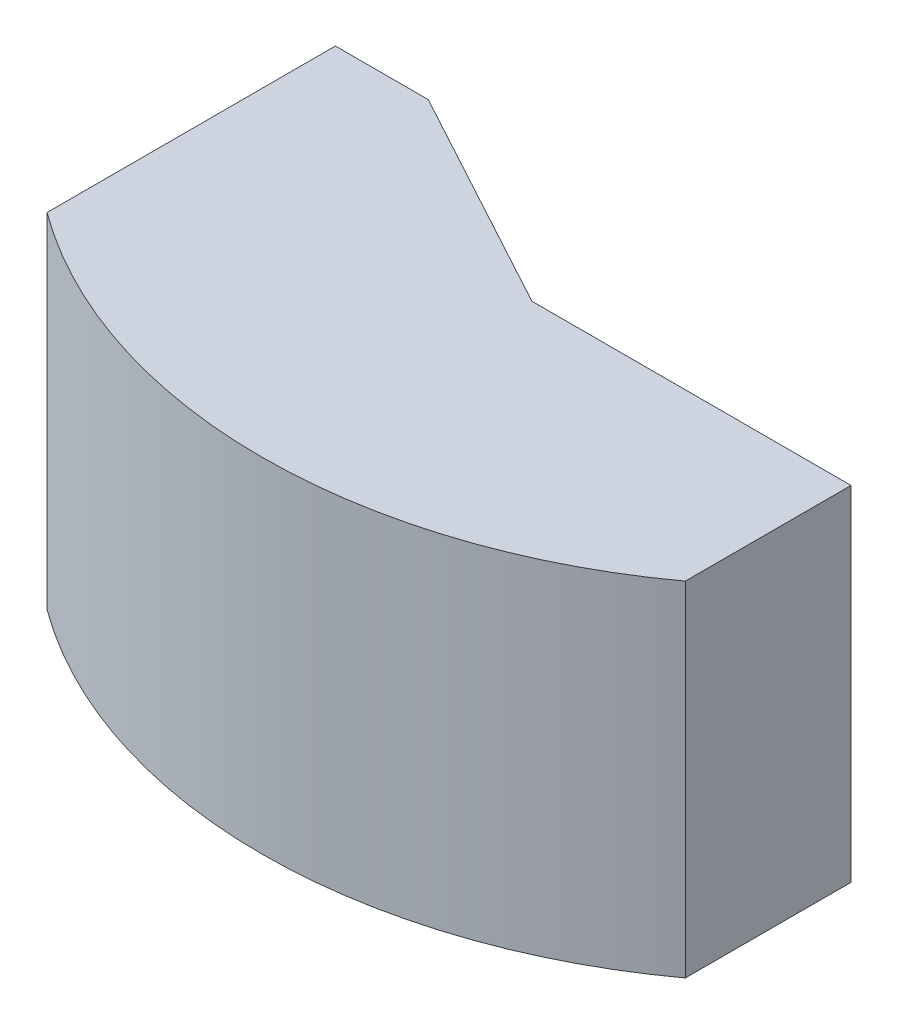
SolidWorks part; units mm, degrees
ref_plane "Front Plane" through (0, 0, 0) normal (0, 0, 1) x (1, 0, 0)
ref_plane "Top Plane" through (0, 0, 0) normal (0, 1, 0) x (1, 0, 0)
ref_plane "Right Plane" through (0, 0, 0) normal (1, 0, 0) x (0, 0, -1)
sketch "Sketch1" plane through (0, 0, 0) normal (0, 0, 1) x (1, 0, 0)
  line L0 (0, 0) -> (0, 88.9688) construction
  line L1 (-12.7, 0) -> (-132.7199, 0) construction
  line L2 (-38.1, 2.54) -> (-38.1, 78.74)
  line L3 (-53.975, 91.44) -> (-139.7, 91.44)
  line L4 (0, 0) -> (-12.7, 0) construction
  line L5 (-38.1, 2.54) -> (-139.7, 2.54)
  line L6 (-139.7, 2.54) -> (-139.7, 91.44)
  line L7 (-53.975, 91.44) -> (-41.275, 78.74)
  line L8 (-41.275, 78.74) -> (-38.1, 78.74)
  dimension "D1" = 88.9
  dimension "D2" = 76.2
  dimension "D3" = 76.2
  dimension "D4" = 2.54
  dimension "D5" = 279.4
  dimension "D6" = 3.175
  dimension "D7" = 135
revolve "Revolve1" add sketch "Sketch1" angle 360 about L0
sketch "Sketch2" plane through (0, 91.44, 0) normal (0, -1, 0) x (1, 0, 0)
  line L0 (0, 0) -> (0, 50.8) construction
  line L1 (-152.4, 171.9606) -> (-152.4, 130.6562)
  line L2 (82.55, 69.85) -> (82.55, 182.9817)
  line L3 (-82.55, 171.9606) -> (-82.55, 38.1)
  line L4 (-82.55, 38.1) -> (-58.5441, 38.1)
  line L5 (-82.55, 171.9606) -> (-152.4, 171.9606)
  line L6 (0, 69.85) -> (-58.5441, 38.1)
  line L8 (0, 69.85) -> (82.55, 69.85)
  arc A0 (-152.4, 130.6562) -> (82.55, 182.9817) centre (0, 0) ccw
  arc A1 (0, 69.85) -> (-58.5441, 38.1) centre (0, 0) ccw construction
  dimension "D6" = 69.85
  dimension "D1" = 50.8
  dimension "D2" = 82.55
  dimension "D3" = 152.4
  dimension "D4" = 38.1
  dimension "D5" = 82.55
extrude "Cut-Extrude1" cut sketch "Sketch2" along normal through all
